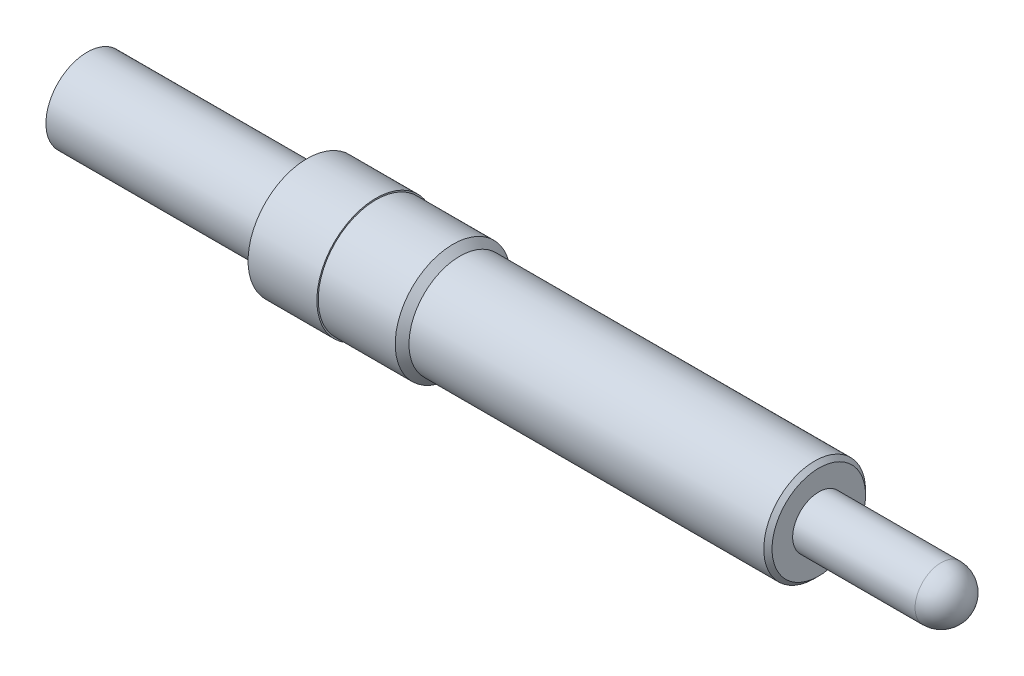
SolidWorks part; units mm, degrees
ref_plane "Front Plane" through (0, 0, 0) normal (0, 0, 1) x (1, 0, 0)
ref_plane "Top Plane" through (0, 0, 0) normal (0, 1, 0) x (1, 0, 0)
ref_plane "Right Plane" through (0, 0, 0) normal (1, 0, 0) x (0, 0, -1)
sketch "Sketch1" plane through (0, 0, 0) normal (0, 0, 1) x (1, 0, 0)
  line L0 (0, 0) -> (-23.7325, 0) construction
  line L1 (55, 0) -> (-55, 0) construction
  line L2 (0, 0) -> (0, 0.381)
  line L3 (0, 0.381) -> (2.032, 0.381)
  line L4 (2.032, 0.381) -> (2.032, 0.5461)
  line L5 (2.032, 0.5461) -> (2.667, 0.5461)
  line L6 (2.667, 0.5461) -> (2.667, 0.5334)
  line L7 (2.667, 0.5334) -> (3.3782, 0.5334)
  line L8 (3.3782, 0.5334) -> (3.3782, 0.4699)
  line L9 (6.7564, 0.2413) -> (7.8867, 0.2413)
  line L10 (8.128, 0) -> (0, 0)
  line L11 (3.3782, 0.4699) -> (6.7564, 0.4699)
  line L12 (6.7564, 0.4699) -> (6.7564, 0.2413)
  arc A0 (7.8867, 0.2413) -> (8.128, 0) centre (7.8867, 0) cw
  dimension "D1" = 0.762
  dimension "D2" = 1.0922
  dimension "D3" = 1.0668
  dimension "D4" = 0.9398
  dimension "D5" = 0.4826
  dimension "D6" = 2.032
  dimension "D7" = 0.635
  dimension "D8" = 0.7112
  dimension "D9" = 4.7244
  dimension "D10" = 8.128
revolve "Revolve1" add sketch "Sketch1" angle 360 about L0
chamfer "Chamfer1" distance 0.0635 angle 45 1 edges at (3.3782, 0, -0.4699)
chamfer "Chamfer2" distance 0.0381 angle 45 1 edges at (6.7564, 0, -0.4699)
